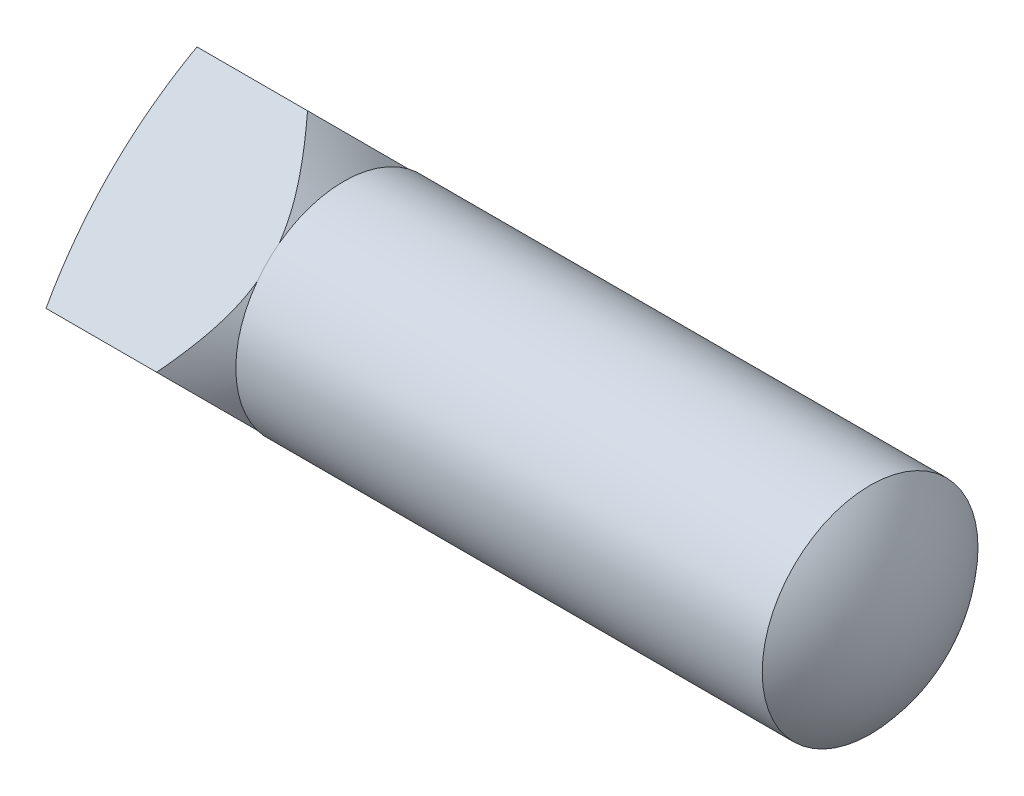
SolidWorks part; units mm, degrees
ref_plane "Plane1" through (0, 0, 0) normal (0, 0, 1) x (1, 0, 0)
ref_plane "Plane2" through (0, 0, 0) normal (0, 1, 0) x (1, 0, 0)
ref_plane "Plane3" through (0, 0, 0) normal (1, 0, 0) x (0, 0, -1)
sketch "BodySke" plane through (0, 0, 0) normal (0, 0, 1) x (1, 0, 0)
  line L0 (2.5522, -2.413) -> (11.774, -2.413) construction
  line L1 (0, 0) -> (0, 2.413)
  line L2 (0, 2.413) -> (11.774, 2.413)
  line L3 (0.7874, 6.35) -> (0.7874, 0) construction
  line L4 (12.7, 0) -> (0, 0)
  line L5 (-12.7, 0) -> (88.9, 0) construction
  line L6 (0, 6.35) -> (0, -6.35) construction
  arc A0 (12.7, 0) -> (11.774, 2.413) centre (9.0932, 0) ccw
  dimension "Or" = 3.6068
  dimension "Length" = 12.7
  dimension "Diameter" = 4.826
  dimension "Adv" = 0.7874
  dimension "Thread_nom" = 12.7
revolve "BaseBody" add sketch "BodySke"
pattern_linear "ThdSchPat" [suppressed]
revolve "ThreadSchematic" cut sketch "ThdSchSke" angle 360 about L5
sketch "ThdSchSke" plane through (0, 0, 0) normal (0, 0, 1) x (1, 0, 0)
  line L0 (0.7874, -1.9406) -> (0.4566, -2.413)
  line L1 (0.7874, -1.9406) -> (1.1182, -2.413)
  line L2 (1.1182, -2.413) -> (1.1182, -3.0162)
  line L3 (-3.175, 0) -> (5.1513, 0) construction
  line L5 (1.1182, -3.0162) -> (0.4566, -3.0162)
  line L6 (0.4566, -3.0162) -> (0.4566, -2.413)
  dimension "D1" = 360
  dimension "Thread_minor" = 3.8811
  dimension "D2" = 1
  dimension "Diameter" = 4.826
  dimension "Start" = 0.7874
  dimension "D4" = 50
  dimension "SideAngle" = 55
  dimension "VeeAngle" = 70
  dimension "Overcut" = 6.0325
  dimension "Num_threads" = 15
  dimension "Advance" = 0.7848
sketch "Sketch4" plane through (0, 0, 0) normal (-1, 0, 0) x (0, -0.7071, 0.7071)
  line L1 (-2.3876, -2.3876) -> (2.3876, -2.3876)
  line L2 (-2.3876, -2.3876) -> (-2.3876, 2.3876)
  line L3 (-2.3876, 2.3876) -> (2.3876, 2.3876)
  line L4 (2.3876, -2.3876) -> (2.3876, 2.3876)
  dimension "D1" = 4.7752
  dimension "Width_flats" = 4.7752
  dimension "D2" = 2.3876
  dimension "D3" = 2.3876
extrude "BaseHead" add sketch "Sketch4" along normal blind 3.7592
sketch "Sketch5" plane through (0, 0, 0) normal (0, 0, 1) x (1, 0, 0)
  line L0 (-3.7592, 0) -> (-16.4592, 0)
  line L1 (0, 0) -> (57.15, 0) construction
  line L2 (-12.7, 0) -> (88.9, 0) construction
  line L3 (-16.4592, 0) -> (-16.4592, 3.3766)
  line L5 (-16.4592, 3.3766) -> (-3.2823, 3.3766)
  line L6 (-3.7592, 3.3766) -> (0, 3.3766) construction
  arc A0 (-3.2823, 3.3766) -> (-3.7592, 0) centre (8.4328, 0) ccw
  dimension "Head_radius" = 12.192
  dimension "D2" = 8.4328
  dimension "D3" = 12.7
revolve "HeadCrown" cut sketch "Sketch5" angle 360 about L1
sketch "Sketch6" plane through (0, 0, 0) normal (0, 0, 1) x (1, 0, 0)
  line L0 (0, 2.413) -> (-0.8085, 3.3766)
  line L3 (0, 1.9352) -> (0, 3.3766) construction
  line L4 (-3.2823, 3.3766) -> (0, 3.3766) construction
  line L5 (-0.8085, 3.3766) -> (-0.8085, 16.0766)
  line L6 (0, 2.413) -> (12.7, 2.413)
  line L7 (12.7, 2.413) -> (12.7, 16.0766)
  line L8 (12.7, 16.0766) -> (-0.8085, 16.0766)
  line L9 (0, 0) -> (60.325, 0) construction
  dimension "D1" = 40
  dimension "D2" = 12.7
  dimension "D3" = 12.7
  dimension "D4" = 2.413
revolve "HeadChamfer1" cut sketch "Sketch6" angle 360 about L9
equation "\"D1@Sketch4\" = \"Width_flats@Sketch4\""
equation "\"D2@Sketch4\" = \"Width_flats@Sketch4\" / 2"
equation "\"D3@Sketch4\" = \"Width_flats@Sketch4\" / 2"
equation "\"D2@Sketch5\" = \"Head_radius@Sketch5\" - \"Head_ht@BaseHead\""
equation "\"TV1\"= (sgn((\"Length@BodySke\"-\"Adv@BodySke\"-(\"Or@BodySke\"-sqr((\"Or@BodySke\" * \"Or@BodySke\")-((\"Diameter@BodySke\"*0.5)*( \"Diameter@BodySke\" * 0.5 ) )))) - \"Thread_nom@BodySke\")-1)"
equation "\"TV2\"= ((\"Length@BodySke\"-\"Adv@BodySke\"-(\"Or@BodySke\"-sqr((\"Or@BodySke\"*\"Or@BodySke\")-((\"Diameter@BodySke\"*0.5)*(\"Diameter@BodySke\"*0.5)))))-\"Thread_nom@BodySke\")"
equation "\"Thread_length@ThreadCosmetic\"= (\"TV1\" * \"TV2\")/-2+\"Thread_nom@BodySke\""
equation "\"Thread_minor@ThdSchSke\" = \"Thread_minor@ThreadCosmetic\""
equation "\"Diameter@ThdSchSke\" = \"Diameter@BodySke\""
equation "\"Overcut@ThdSchSke\" = \"Diameter@BodySke\" * 1.25"
equation "\"Start@ThdSchSke\" = (\"Length@BodySke\" - ( \"Or@BodySke\" - sqr ( ( \"Or@BodySke\" * \"Or@BodySke\" ) - ( ( \"Diameter@BodySke\" * 0.5 ) * ( \"Diameter@BodySke\" * 0.5 ) ) ) ) ) - \"Thread_length@ThreadCosmetic\" "
equation "\"Num_threads@ThdSchPat\" = int( \"Thread_length@ThreadCosmetic\" / \"Adv@BodySke\" + 0.999 )  + 1"
equation "\"Advance@ThdSchPat\" = \"Thread_length@ThreadCosmetic\" /  (\"Num_threads@ThdSchPat\" - 1) 'relax it"
equation "' \"Num_threads@ThdSchPat\" = \"Num_threads@ThdSchPat\" - sgn( \"Num_threads@ThdSchPat\" - 1) '---chamfered tips only---"
equation "\"D4@Sketch6\" = \"Diameter@BodySke\" / 2.0"
